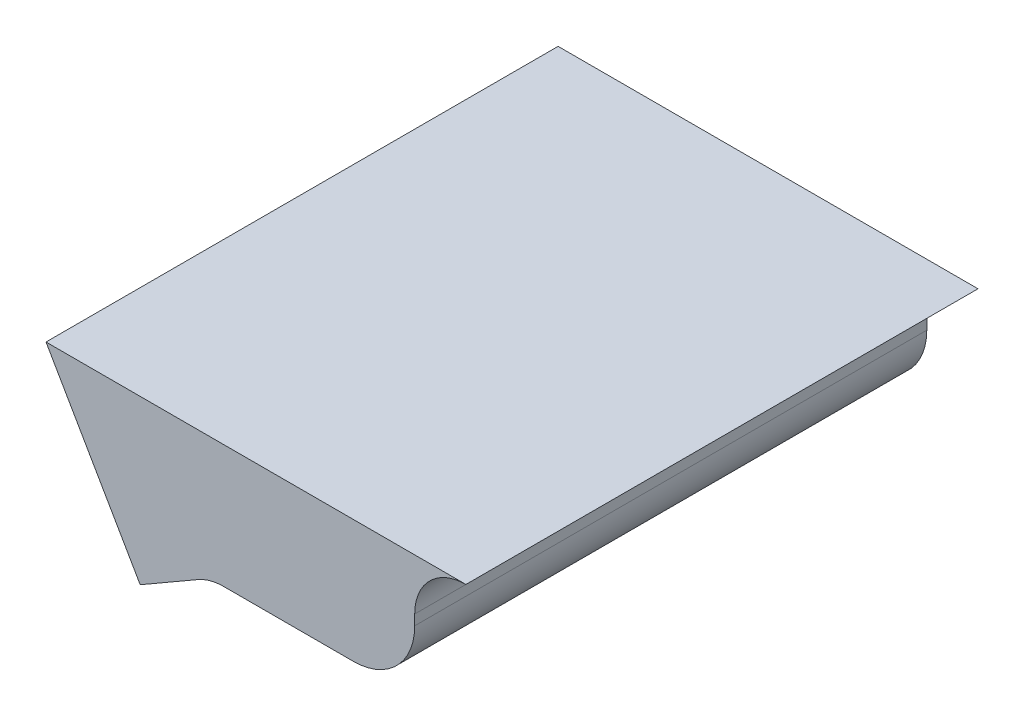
SolidWorks part; units mm, degrees
ref_plane "Plane1" through (0, 0, 0) normal (0, 0, 1) x (1, 0, 0)
ref_plane "Plane2" through (0, 0, 0) normal (0, 1, 0) x (1, 0, 0)
ref_plane "Plane3" through (0, 0, 0) normal (1, 0, 0) x (0, 0, -1)
sketch "Sketch1" plane through (0, 0, 0) normal (0, 0, 1) x (1, 0, 0)
  line L0 (-25, 5) -> (25, 5)
  line L1 (-25, 5) -> (-25, 0)
  line L2 (25, 0) -> (-25, 0)
  line L3 (25, 0) -> (25, 5)
  line L4 (0, 5) -> (0, 0) construction
  line L5 (50, 0) -> (-50, 0) construction
  dimension "D1" = 50
  dimension "D2" = 5
extrude "Base-Extrude" add sketch "Sketch1" along normal mid plane 50
sketch "Lance Tool sketch" plane through (0, 0, 0) normal (0, 0, 1) x (1, 0, 0)
  line L0 (9, 0) -> (-9, 0)
  line L1 (9, 0) -> (9, -6)
  line L2 (9, -6) -> (-1, -6)
  line L3 (-1, -6) -> (-4.4019, -7.9641)
  line L4 (-9, 0) -> (-4.4019, -7.9641)
  line L5 (25, 0) -> (-25, 0) construction
  line L6 (0, 0) -> (0, -6) construction
  dimension "Height from Drop Face" = 6
  dimension "Opening Width" = 18
  dimension "Form Width" = 10
  dimension "Bend Angle" = 150
extrude "Lance Tool" add sketch "Lance Tool sketch" along normal mid plane 25
fillet "Inside Fillet" radius 2.5 2 edges at (9, 0, 0) (-1, -6, 0)
fillet "Round" radius 3 1 edges at (9, -6, 0)
sketch "Sketch3" plane through (25, 0, 0) normal (1, 0, 0) x (0, 0, -1)
  line L4 (25, 5) -> (-25, 5)
  line L5 (-25, 5) -> (-25, 0)
  line L6 (-25, 0) -> (25, 0)
  line L7 (25, 0) -> (25, 5)
  line L8 (25, 5) -> (-25, 5)
  line L9 (-25, 5) -> (-25, 0)
  line L10 (-25, 0) -> (25, 0)
  line L11 (25, 0) -> (25, 5)
  dimension "D1" = 0
extrude "Cleanup cut" cut sketch "Sketch3" against normal through all
sketch "Orientation sketch" plane through (0, 0, 0) normal (0, 1, 0) x (-1, 0, 0)
  line L4 (9, 12.5) -> (-11.5, 12.5)
  line L5 (-11.5, 12.5) -> (-11.5, -12.5)
  line L6 (-11.5, -12.5) -> (9, -12.5)
  line L7 (9, -12.5) -> (9, 12.5)
  line L8 (9, 12.5) -> (-11.5, 12.5)
  line L9 (-11.5, 12.5) -> (-11.5, -12.5)
  line L10 (-11.5, -12.5) -> (9, -12.5)
  line L11 (9, -12.5) -> (9, 12.5)
  dimension "D1" = 0
